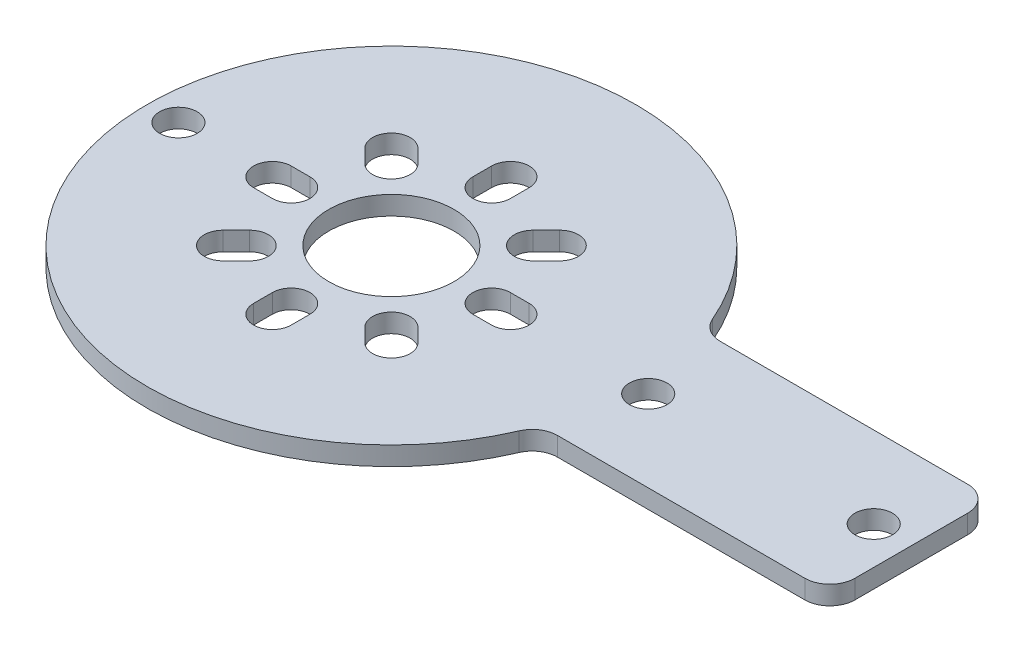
SolidWorks part; units mm, degrees
ref_plane "Спереди" through (0, 0, 0) normal (0, 0, 1) x (1, 0, 0)
ref_plane "Сверху" through (0, 0, 0) normal (0, 1, 0) x (1, 0, 0)
ref_plane "Справа" through (0, 0, 0) normal (1, 0, 0) x (0, 0, -1)
sketch "Эскиз1" plane through (0, 0, 0) normal (0, 1, 0) x (1, 0, 0)
  line L0 (40.5311, 6.2137) -> (41.5, 6.5) construction
  line L1 (19.7484, -6.5) -> (39.5, -6.5)
  line L3 (19.7484, 6.5) -> (39.5, 6.5)
  line L4 (41.5, -4.5) -> (41.5, 4.5)
  line L6 (40.5311, -6.2137) -> (41.5, -6.5) construction
  arc A0 (17.9114, 7.7093) -> (17.9114, -7.7093) centre (0, 0) ccw
  arc A1 (39.5, -6.5) -> (41.5, -4.5) centre (39.5, -4.5) ccw
  arc A2 (39.5, 6.5) -> (41.5, 4.5) centre (39.5, 4.5) cw
  arc A3 (19.7484, -6.5) -> (17.9114, -7.7093) centre (19.7484, -8.5) ccw
  arc A4 (19.7484, 6.5) -> (17.9114, 7.7093) centre (19.7484, 8.5) cw
  point P3 (19.5, 0)
  dimension "D1" = 13
  dimension "D3" = 2
  dimension "D2" = 2
extrude "Бобышка-Вытянуть1" add sketch "Эскиз1" along normal blind 1.5
sketch "Эскиз2" plane through (0, 1.5, 0) normal (0, 1, 0) x (1, 0, 0)
  circle A0 centre (0, 0) radius 5
extrude "Вырез-Вытянуть1" cut sketch "Эскиз2" against normal through all
sketch "Эскиз3" plane through (0, 1.5, 0) normal (0, 1, 0) x (1, 0, 0)
  line L0 (8, 0) -> (9.5, 0) construction
  line L1 (8, 1.5) -> (9.5, 1.5)
  line L2 (8, -1.5) -> (9.5, -1.5)
  line L3 (5.6569, -5.6569) -> (6.7175, -6.7175) construction
  line L4 (6.7175, -4.5962) -> (7.7782, -5.6569)
  line L5 (4.5962, -6.7175) -> (5.6569, -7.7782)
  line L6 (0, -8) -> (0, -9.5) construction
  line L7 (1.5, -8) -> (1.5, -9.5)
  line L8 (-1.5, -8) -> (-1.5, -9.5)
  line L9 (-5.6569, -5.6569) -> (-6.7175, -6.7175) construction
  line L10 (-4.5962, -6.7175) -> (-5.6569, -7.7782)
  line L11 (-6.7175, -4.5962) -> (-7.7782, -5.6569)
  line L12 (-8, 0) -> (-9.5, 0) construction
  line L13 (-8, -1.5) -> (-9.5, -1.5)
  line L14 (-8, 1.5) -> (-9.5, 1.5)
  line L15 (-5.6569, 5.6569) -> (-6.7175, 6.7175) construction
  line L16 (-6.7175, 4.5962) -> (-7.7782, 5.6569)
  line L17 (-4.5962, 6.7175) -> (-5.6569, 7.7782)
  line L18 (0, 8) -> (0, 9.5) construction
  line L19 (-1.5, 8) -> (-1.5, 9.5)
  line L20 (1.5, 8) -> (1.5, 9.5)
  line L21 (5.6569, 5.6569) -> (6.7175, 6.7175) construction
  line L22 (4.5962, 6.7175) -> (5.6569, 7.7782)
  line L23 (6.7175, 4.5962) -> (7.7782, 5.6569)
  arc A0 (8, 1.5) -> (8, -1.5) centre (8, 0) ccw
  arc A1 (9.5, -1.5) -> (9.5, 1.5) centre (9.5, 0) ccw
  circle A2 centre (0, 0) radius 5 construction
  arc A3 (6.7175, -4.5962) -> (4.5962, -6.7175) centre (5.6569, -5.6569) ccw
  arc A4 (5.6569, -7.7782) -> (7.7782, -5.6569) centre (6.7175, -6.7175) ccw
  arc A5 (1.5, -8) -> (-1.5, -8) centre (0, -8) ccw
  arc A6 (-1.5, -9.5) -> (1.5, -9.5) centre (0, -9.5) ccw
  arc A7 (-4.5962, -6.7175) -> (-6.7175, -4.5962) centre (-5.6569, -5.6569) ccw
  arc A8 (-7.7782, -5.6569) -> (-5.6569, -7.7782) centre (-6.7175, -6.7175) ccw
  arc A9 (-8, -1.5) -> (-8, 1.5) centre (-8, 0) ccw
  arc A10 (-9.5, 1.5) -> (-9.5, -1.5) centre (-9.5, 0) ccw
  arc A11 (-6.7175, 4.5962) -> (-4.5962, 6.7175) centre (-5.6569, 5.6569) ccw
  arc A12 (-5.6569, 7.7782) -> (-7.7782, 5.6569) centre (-6.7175, 6.7175) ccw
  arc A13 (-1.5, 8) -> (1.5, 8) centre (0, 8) ccw
  arc A14 (1.5, 9.5) -> (-1.5, 9.5) centre (0, 9.5) ccw
  arc A15 (4.5962, 6.7175) -> (6.7175, 4.5962) centre (5.6569, 5.6569) ccw
  arc A16 (7.7782, 5.6569) -> (5.6569, 7.7782) centre (6.7175, 6.7175) ccw
  point P3 (8.75, 0)
  point P15 (6.1872, -6.1872)
  point P22 (0, -8.75)
  point P29 (-6.1872, -6.1872)
  point P36 (-8.75, 0)
  point P43 (-6.1872, 6.1872)
  point P50 (0, 8.75)
  point P57 (6.1872, 6.1872)
  point P62 (0, 0)
  dimension "D3" = 8
  dimension "D4" = 8
  dimension "D1" = 3
  dimension "D2" = 1.5
extrude "Вырез-Вытянуть2" cut sketch "Эскиз3" against normal through all
sketch "Эскиз4" plane through (0, 1.5, 0) normal (0, 1, 0) x (1, 0, 0)
  line L0 (41.5, -4.5) -> (41.5, 4.5) construction
  circle A0 centre (-17, 0) radius 1.5
  circle A1 centre (20.5, 0) radius 1.5
  circle A2 centre (38.5, 0) radius 1.5
  arc A3 (17.9114, 7.7093) -> (17.9114, -7.7093) centre (0, 0) ccw construction
  dimension "D1" = 17
  dimension "D2" = 3
  dimension "D3" = 18
extrude "Вырез-Вытянуть3" cut sketch "Эскиз4" against normal through all
